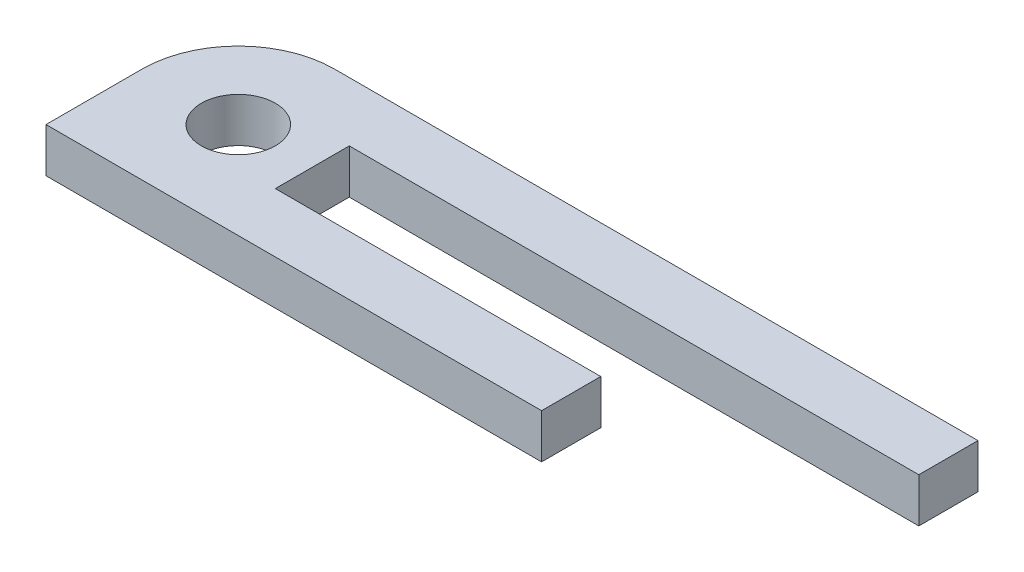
SolidWorks part; units mm, degrees
ref_plane "Front" through (0, 0, 0) normal (0, 0, 1) x (1, 0, 0)
ref_plane "Top" through (0, 0, 0) normal (0, 1, 0) x (1, 0, 0)
ref_plane "Right" through (0, 0, 0) normal (1, 0, 0) x (0, 0, -1)
sketch "Sketch1" plane through (0, 0, 0) normal (0, 1, 0) x (1, 0, 0)
  line L1 (0, 0) -> (67, 0)
  line L2 (0, 0) -> (0, 13)
  line L3 (13, 26) -> (100, 26)
  line L4 (23, 18) -> (100, 18)
  line L7 (67, 0) -> (67, 8)
  line L10 (100, 18) -> (100, 26)
  line L11 (23, 8) -> (67, 8)
  line L18 (23, 8) -> (23, 18)
  circle A0 centre (13, 13) radius 5
  arc A1 (13, 26) -> (0, 13) centre (13, 13) ccw
extrude "Extrude1" add sketch "Sketch1" along normal blind 6
